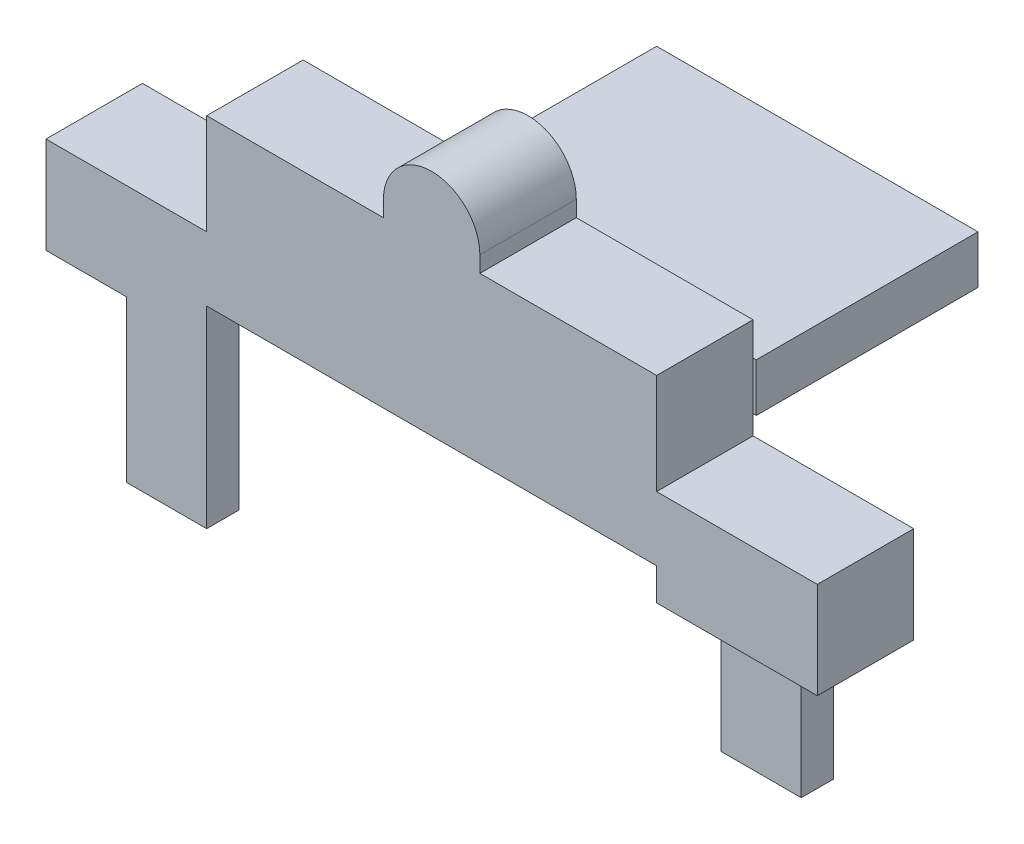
SolidWorks part; units mm, degrees
ref_plane "Front Plane" through (0, 0, 0) normal (0, 0, 1) x (1, 0, 0)
ref_plane "Top Plane" through (0, 0, 0) normal (0, 1, 0) x (1, 0, 0)
ref_plane "Right Plane" through (0, 0, 0) normal (1, 0, 0) x (0, 0, -1)
sketch "Sketch2" plane through (0, 0, 0) normal (0, 0, 1) x (1, 0, 0)
  line L0 (0, 0) -> (-14, 0)
  line L1 (-14, 0) -> (-14, 5.13)
  line L2 (-14, 5.13) -> (0, 5.13)
  line L4 (0, 5.13) -> (0, 0)
  line L5 (-7, 5.63) -> (-7, 4.63) construction
  line L6 (-5.5, 5.63) -> (-5.5, 4.63)
  line L7 (-8.5, 5.63) -> (-8.5, 4.63)
  arc A0 (-5.5, 5.63) -> (-8.5, 5.63) centre (-7, 5.63) ccw
  arc A1 (-8.5, 4.63) -> (-5.5, 4.63) centre (-7, 4.63) ccw
  point P9 (-7, 5.13)
  dimension "D1" = 1.5
  dimension "D2" = 1
  dimension "D3" = 14
  dimension "D4" = 5.13
extrude "Boss-Extrude1" add sketch "Sketch2" along normal blind 3
sketch "Sketch3" plane through (0, 0, 0) normal (0, -1, 0) x (1, 0, 0)
  line L0 (0, 3) -> (-14, 3) construction
  line L1 (-12, 3) -> (-2, 3)
  line L2 (-12, 3) -> (-12, -9)
  line L3 (-12, -9) -> (-2, -9)
  line L4 (-2, 3) -> (-2, -9)
  line L5 (0, 0) -> (-14, 0) construction
  point P6 (-7, -9)
  point P9 (-7, 0)
  dimension "D1" = 12
  dimension "D2" = 10
extrude "Boss-Extrude2" add sketch "Sketch3" against normal blind 2
sketch "Sketch4" plane through (0, 0, 0) normal (0, -1, 0) x (1, 0, 0)
  line L0 (0, 3) -> (0, 0) construction
  line L5 (-19, 3) -> (-14, 3)
  line L6 (-19, 3) -> (-19, 0)
  line L7 (-19, 0) -> (-14, 0)
  line L8 (-14, 3) -> (-14, 0)
  line L9 (-19, 3) -> (-14, 0) construction
  line L10 (-19, 0) -> (-14, 3) construction
  line L11 (-14, 3) -> (-14, 0) construction
  line L17 (0, 3) -> (5, 3)
  line L18 (0, 3) -> (0, 0)
  line L19 (0, 0) -> (5, 0)
  line L20 (5, 3) -> (5, 0)
  line L21 (0, 3) -> (5, 0) construction
  line L22 (0, 0) -> (5, 3) construction
  point P2 (-14, 1.5)
  point P5 (-16.5, 1.5)
  point P10 (0, 1.5)
  point P20 (2.5, 1.5)
  dimension "D2" = 5
  dimension "D3" = 3
extrude "Boss-Extrude3" add sketch "Sketch4" against normal blind 2 and the other way blind 1
sketch "Sketch7" plane through (0, 0, 0) normal (0, -1, 0) x (1, 0, 0)
  line L0 (0, 1) -> (2.5, 1)
  line L1 (-16.5, 3) -> (-14, 3)
  line L2 (-16.5, 3) -> (-16.5, 2)
  line L3 (-16.5, 2) -> (-14, 2)
  line L4 (-14, 3) -> (-14, 2)
  line L9 (0, 1) -> (0, 0)
  line L10 (0, 0) -> (2.5, 0)
  line L11 (2.5, 1) -> (2.5, 0)
  line L16 (0, 3) -> (-14, 3) construction
  line L17 (0, 0) -> (-2, 0) construction
  line L18 (-12, 0) -> (-14, 0) construction
  line L19 (-14, 3) -> (-14, 0) construction
  line L20 (0, 3) -> (0, 0) construction
  dimension "D1" = 2.5
  dimension "D2" = 1
extrude "Boss-Extrude4" add sketch "Sketch7" along normal blind 6
sketch "Sketch9" plane through (0, 0, 0) normal (0, -1, 0) x (1, 0, 0)
  line L1 (-12, 0) -> (-9.85, 0)
  line L2 (-12, 0) -> (-12, -2.1)
  line L3 (-12, -2.1) -> (-9.85, -2.1)
  line L4 (-9.85, 0) -> (-9.85, -2.1)
  line L5 (-2, 0) -> (-4.15, 0)
  line L6 (-2, 0) -> (-2, -2.1)
  line L7 (-2, -2.1) -> (-4.15, -2.1)
  line L8 (-4.15, 0) -> (-4.15, -2.1)
  dimension "D1" = 2.15
  dimension "D2" = 2.1
  dimension "D3" = 2.15
extrude "Cut-Extrude1" cut sketch "Sketch9" against normal blind 10
sketch "Sketch10" plane through (0, 0, 0) normal (0, -1, 0) x (-1, 0, 0)
  line L1 (12, 0) -> (2, 0)
  line L2 (12, 0) -> (12, 9)
  line L3 (12, 9) -> (2, 9)
  line L4 (2, 0) -> (2, 9)
  line L6 (12, 2.1) -> (12, 9) construction
extrude "Cut-Extrude2" cut sketch "Sketch10" against normal blind 0.5
sketch "Sketch11" plane through (0, 0.5, 0) normal (0, -1, 0) x (1, 0, 0)
  line L1 (-9.85, 0) -> (-4.15, 0)
  line L2 (-9.85, 0) -> (-9.85, -2.1)
  line L3 (-9.85, -2.1) -> (-4.15, -2.1)
  line L4 (-4.15, 0) -> (-4.15, -2.1)
extrude "Boss-Extrude5" add sketch "Sketch11" along normal up to surface (0.5 mm away)
equation "\".5.00mm\"=2"
